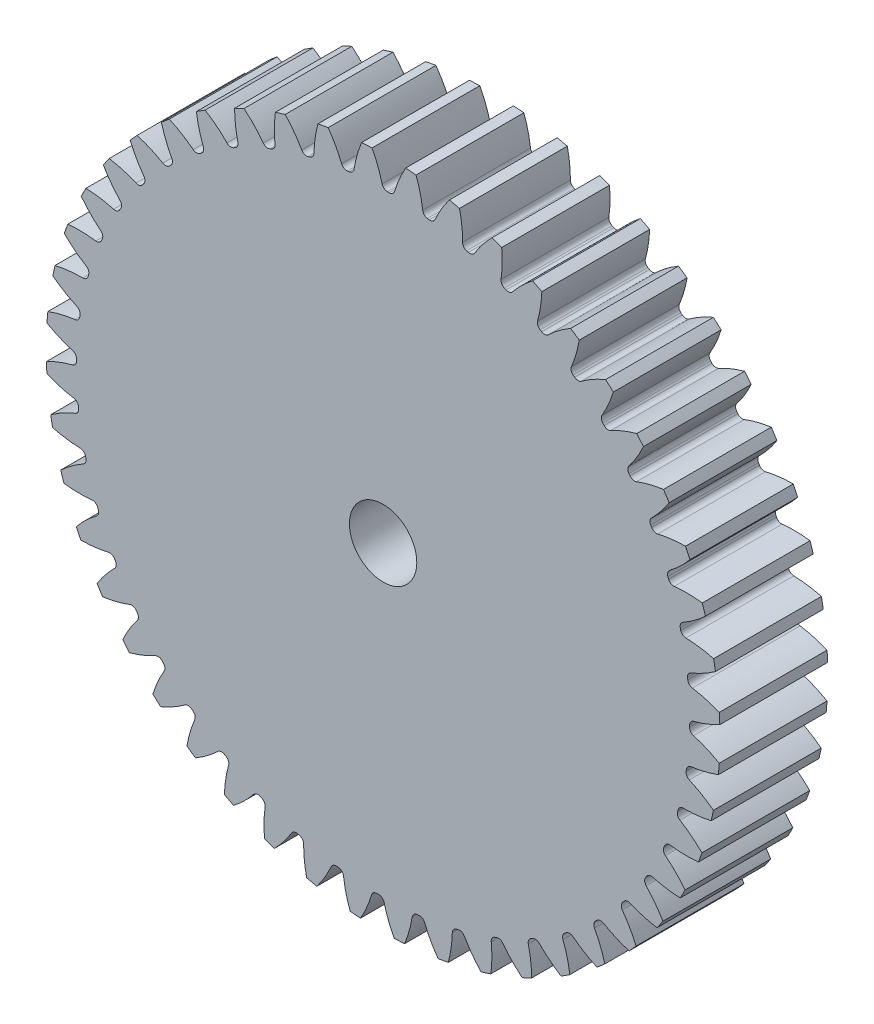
SolidWorks part; units mm, degrees
ref_plane "Front" through (0, 0, 0) normal (0, 0, 1) x (1, 0, 0)
ref_plane "Top" through (0, 0, 0) normal (0, 1, 0) x (1, 0, 0)
ref_plane "Right" through (0, 0, 0) normal (1, 0, 0) x (0, 0, -1)
sketch "Sketch3" plane through (0, 0, 0) normal (0, 0, 1) x (1, 0, 0)
  circle A0 centre (0, 0) radius 317.5
  dimension "od" = 635
extrude "gearBody" add sketch "Sketch3" along normal blind 101.6
sketch "Sketch2" plane through (0, 0, 0) normal (0, 0, 1) x (1, 0, 0)
  line L0 (0, 0) -> (264.616, 109.6075) construction
  line L1 (316.9562, -21.3643) -> (0, 0) construction
  line L2 (0, 0) -> (36.3143, 0) construction
  line L3 (304.7631, 4.7442) -> (304.4246, -15.1229) construction
  line L5 (304.5938, -5.1893) -> (0, 0) construction
  line L7 (0, 0) -> (286.4183, 0) construction
  arc A0 (286.4178, -0.5414) -> (286.27, -9.2155) centre (0, 0) ccw construction
  arc A1 (317.3275, 10.4632) -> (316.787, -21.2666) centre (0, 0) ccw construction
  arc A2 (304.7631, 4.7442) -> (304.4246, -15.1229) centre (0, 0) ccw construction
  arc A3 (288.8664, -5.82) -> (288.897, -4.0233) centre (0, 0) ccw
  arc A4 (316.9562, -21.3643) -> (292.5685, -10.8808) centre (260.7288, -118.5578) ccw
  arc A5 (316.9562, -21.3643) -> (317.5, 10.5551) centre (0, 0) ccw
  arc A6 (317.5, 10.5551) -> (292.7694, 0.9085) centre (264.616, 109.6075) cw
  arc A7 (288.897, -4.0233) -> (292.7694, 0.9085) centre (294.0654, -4.0953) cw
  arc A8 (292.5685, -10.8808) -> (288.8664, -5.82) centre (294.0342, -5.9241) cw
  point P6 (317.5, 10.5551)
  point P22 (316.9562, -21.3643)
  dimension "baseDia" = 572.8366
  dimension "od" = 635
  dimension "pd" = 609.6
  dimension "rd" = 577.85
  dimension "rFillet" = 5.1689
  dimension "pointX" = 317.5
  dimension "pointY" = 10.5551
  dimension "CTT" = 19.8672
  dimension "flankCenterAngle" = 22.5
extrude "toothCut" cut sketch "Sketch2" along normal through all
pattern_circular "CirPattern1" count 48 over 360 about axis through (0, 0, 0) along (0, 0, 1) of "toothCut"
sketch "hub1Dia" plane through (0, 0, 0) normal (0, 0, -1) x (-1, 0, 0)
  circle A0 centre (0, 0) radius 12.7
  dimension "hub1Dia" = 25.4
sketch "hub2Dia" plane through (0, 0, 101.6) normal (0, 0, 1) x (1, 0, 0)
  circle A0 centre (0, 0) radius 12.7
  dimension "hub2dia" = 25.4
sketch "boreDia" plane through (0, 0, 0) normal (0, 0, 1) x (1, 0, 0)
  circle A0 centre (0, 0) radius 31.75
  dimension "boreDia" = 63.5
extrude "bore" cut sketch "boreDia" against normal mid plane 25400
